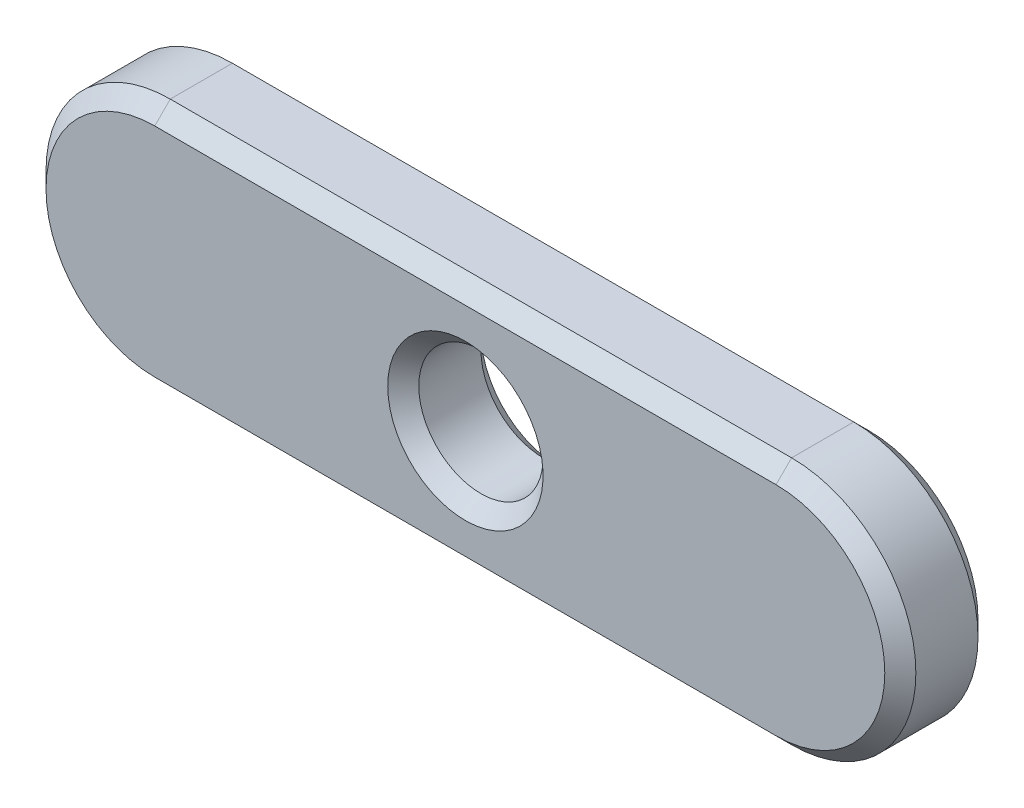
SolidWorks part; units mm, degrees
ref_plane "Plan1" through (0, 0, 0) normal (0, 0, 1) x (1, 0, 0)
ref_plane "Plan2" through (0, 0, 0) normal (0, 1, 0) x (1, 0, 0)
ref_plane "Plan3" through (0, 0, 0) normal (1, 0, 0) x (0, 0, -1)
sketch "Esquisse1" plane through (0, 0, 0) normal (0, 0, 1) x (1, 0, 0)
  line L0 (-10, 4) -> (10, 4)
  line L1 (-10, -4) -> (10, -4)
  arc A0 (10, 4) -> (10, -4) centre (10, 0) cw
  arc A1 (-10, 4) -> (-10, -4) centre (-10, 0) ccw
extrude "Base-Extrusion" add sketch "Esquisse1" along normal blind 3
sketch "Esquisse2" plane through (0, 0, 3) normal (0, 0, 1) x (1, 0, 0)
  circle A0 centre (0, 0) radius 2
  dimension "D1" = 4
extrude "Enlèv. mat.-Extru.1" cut sketch "Esquisse2" against normal blind 3
chamfer "Chanfrein1" distance 0.5 angle 45
